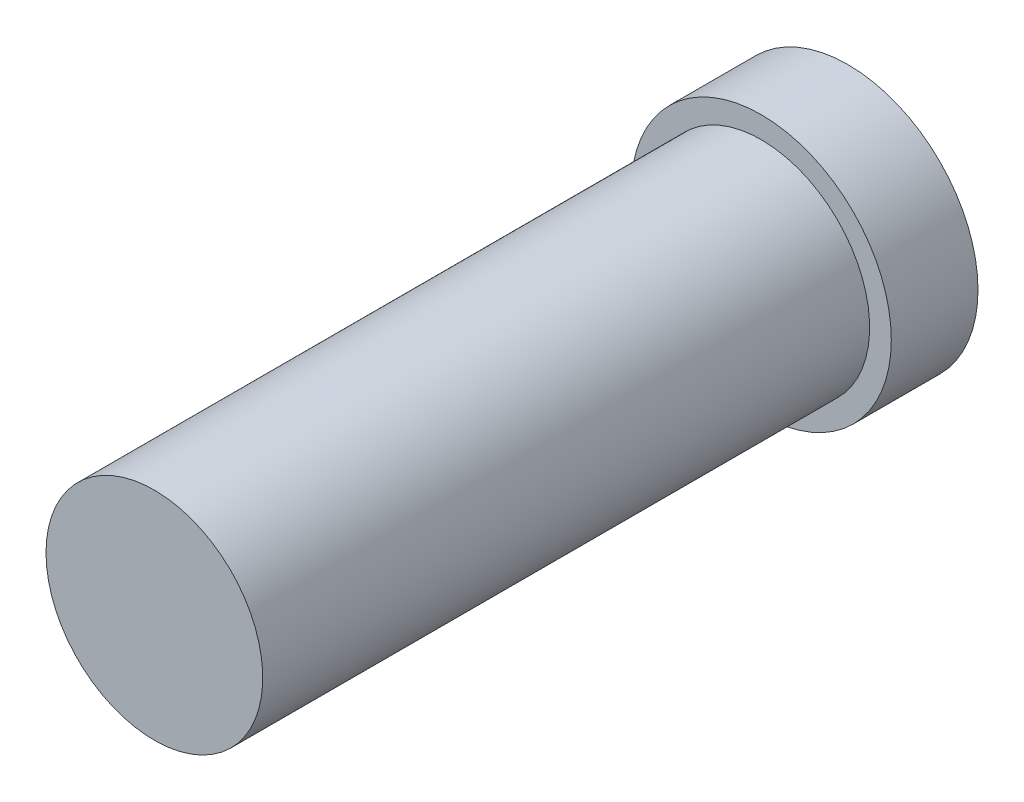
SolidWorks part; units mm, degrees
ref_plane "Front" through (0, 0, 0) normal (0, 0, 1) x (1, 0, 0)
ref_plane "Top" through (0, 0, 0) normal (0, 1, 0) x (1, 0, 0)
ref_plane "Right" through (0, 0, 0) normal (1, 0, 0) x (0, 0, -1)
sketch "Logo3_Revol_Axis" plane through (0, 0, 0) normal (0, 1, 0) x (1, 0, 0)
  line L0 (0, -43.5172) -> (0, 43.5172) construction
sketch "Logo3_bib1" plane through (0, 0, 0) normal (0, -1, 0) x (-1, 0, 0)
  line L0 (7.9375, 0) -> (9.525, 0)
  line L1 (0, 6.35) -> (0, -44.45)
  line L2 (0, -43.5172) -> (0, 43.5172) construction
  line L3 (0, 6.35) -> (9.525, 6.35)
  line L4 (9.525, 0) -> (9.525, 6.35)
  line L7 (0, -44.45) -> (7.9375, -44.45)
  line L8 (7.9375, 0) -> (7.9375, -44.45)
  line L10 (0, 16.5468) -> (0, -90.6614) construction
  dimension "logo3_head_l" = 6.35
  dimension "logo3_l1" = 50.8
  dimension "logo3_d1" = 15.875
  dimension "logo3_head_d" = 19.05
revolve "Revolve1" add sketch "Logo3_bib1" angle 360 about L10
